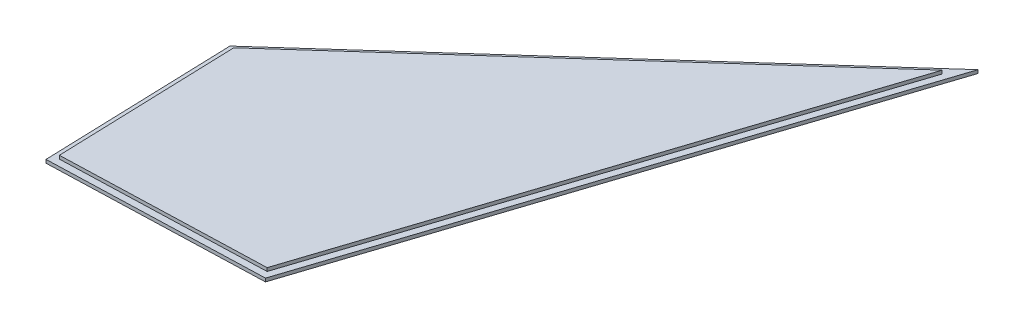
SolidWorks part; units mm, degrees
ref_plane "Front Plane" through (0, 0, 0) normal (0, 0, 1) x (1, 0, 0)
ref_plane "Top Plane" through (0, 0, 0) normal (0, 1, 0) x (1, 0, 0)
ref_plane "Right Plane" through (0, 0, 0) normal (1, 0, 0) x (0, 0, -1)
sketch "Sketch1" plane through (0, 0, 0) normal (0, 1, 0) x (1, 0, 0)
  line L0 (55.849, 77.0109) -> (-55.849, -23.1069)
  line L1 (-54.0884, -77.0109) -> (6.063, -75.0462)
  line L2 (-55.849, -23.1069) -> (-54.0884, -77.0109)
  line L3 (6.063, -75.0462) -> (55.849, 77.0109)
  dimension "D1" = 160
  dimension "D2" = 130
  dimension "D3" = 110
extrude "Boss-Extrude1" add sketch "Sketch1" along normal blind 1
sketch "Sketch2" plane through (0, 0, 0) normal (0, -1, 0) x (1, 0, 0)
  line L8 (60.0722, -83.4821) -> (7.5279, 76.9994)
  line L9 (7.5279, 76.9994) -> (-56.022, 79.0751)
  line L10 (-56.022, 79.0751) -> (-57.8783, 22.2401)
  line L11 (-57.8783, 22.2401) -> (60.0722, -83.4821)
  line L12 (60.0722, -83.4821) -> (7.5279, 76.9994)
  line L13 (7.5279, 76.9994) -> (-56.022, 79.0751)
  line L14 (-56.022, 79.0751) -> (-57.8783, 22.2401)
  line L15 (-57.8783, 22.2401) -> (60.0722, -83.4821)
  dimension "D1" = 2
extrude "Boss-Extrude2" add sketch "Sketch2" along normal blind 1
